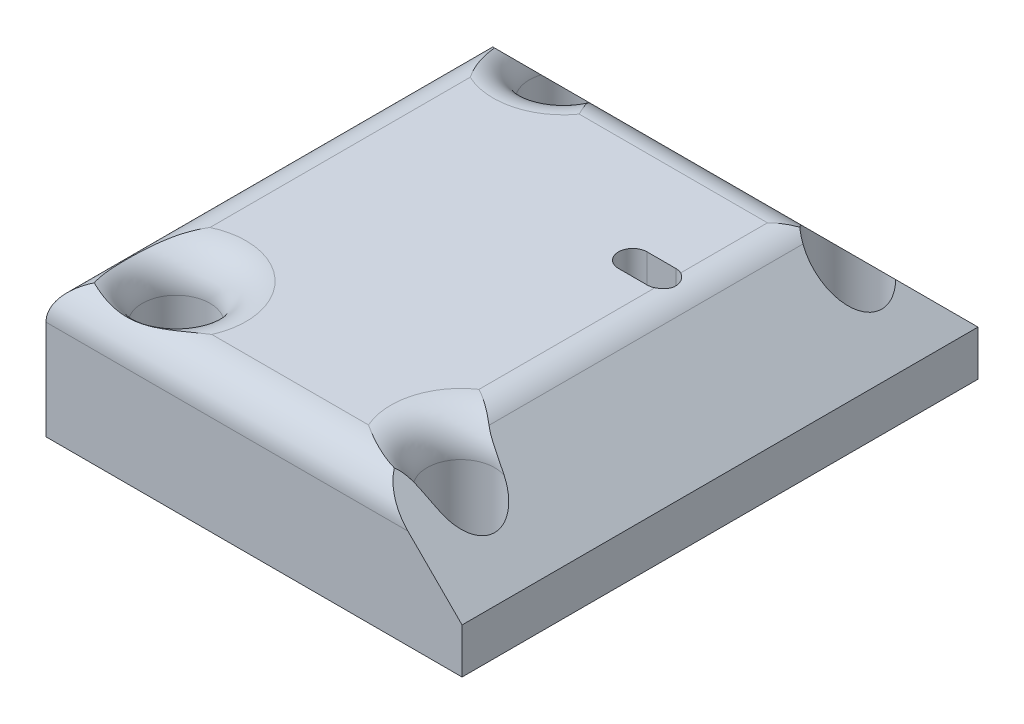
SolidWorks part; units mm, degrees
ref_plane "Front Plane" through (0, 0, 0) normal (0, 0, 1) x (1, 0, 0)
ref_plane "Top Plane" through (0, 0, 0) normal (0, 1, 0) x (1, 0, 0)
ref_plane "Right Plane" through (0, 0, 0) normal (1, 0, 0) x (0, 0, -1)
sketch "Sketch1" plane through (0, 0, 0) normal (0, 1, 0) x (1, 0, 0)
  line L1 (-46.0781, -57.1336) -> (46.0781, -57.1336)
  line L2 (-46.0781, -57.1336) -> (-46.0781, 57.1336)
  line L3 (-46.0781, 57.1336) -> (46.0781, 57.1336)
  line L4 (46.0781, -57.1336) -> (46.0781, 57.1336)
  line L5 (-46.0781, -57.1336) -> (46.0781, 57.1336) construction
  line L6 (-46.0781, 57.1336) -> (46.0781, -57.1336) construction
  point P0 (0, 0)
extrude "Boss-Extrude1" add sketch "Sketch1" against normal blind 30
sketch "Sketch2" plane through (0, 0, 0) normal (0, 1, 0) x (1, 0, 0)
  line L1 (-31.5268, -42.8583) -> (31.5268, -42.8583) construction
  line L2 (-31.5268, -42.8583) -> (-31.5268, 42.8583) construction
  line L3 (-31.5268, 42.8583) -> (31.5268, 42.8583) construction
  line L4 (31.5268, -42.8583) -> (31.5268, 42.8583) construction
  line L5 (-31.5268, -42.8583) -> (31.5268, 42.8583) construction
  line L6 (-31.5268, 42.8583) -> (31.5268, -42.8583) construction
  circle A0 centre (31.5268, 42.8583) radius 7.5
  circle A1 centre (31.5268, -42.8583) radius 7.5
  circle A2 centre (-31.5268, 42.8583) radius 7.5
  circle A3 centre (-31.5268, -42.8583) radius 7.5
  point P0 (0, 0)
  dimension "D1" = 15
  dimension "D2" = 15
  dimension "D3" = 15
  dimension "D4" = 15
extrude "Cut-Extrude1" cut sketch "Sketch2" against normal through all
chamfer "Chamfer1" distance 20 angle 45 2 edges at (0, 0, -57.1336) (46.0781, 0, 0)
fillet "Fillet2" radius 8 7 edges at (-0.3017, 0, -37.1336) (26.0781, 0, 0.2854) (24.0268, 0, 42.8583) (-10, 0, 57.1336) (-46.0781, 0, 10) (-31.5268, 0, -35.3583) (-31.5268, 0, 50.3583)
hole_wizard "1/4 (0.25) Diameter Slot1" positions "Sketch4" profile "Sketch5" size "1/4" standard "ANSI Inch"
sketch "Sketch4" plane through (0, -30, 0) normal (0, -1, 0) x (-1, 0, 0)
  line L0 (-11.8293, 11.7392) -> (-24.5293, 11.7392) construction
  point P0 (-18.1793, 11.7392)
  dimension "D1" = 12.7
sketch "Sketch5" plane through (18.1793, -30, -11.7392) normal (1, 0, 0) x (0, 0, -1)
  line L0 (0, 0) -> (0, 30)
  line L1 (0, 30) -> (3.175, 30)
  line L2 (3.175, 30) -> (3.175, 0)
  line L5 (3.175, 0) -> (0, 0)
  line L11 (0, -6.35) -> (0, 107.95) construction
  dimension "Thru Hole Dia." = 6.35
  dimension "Thru Hole Depth" = 30
fillet "Fillet1" radius 3
